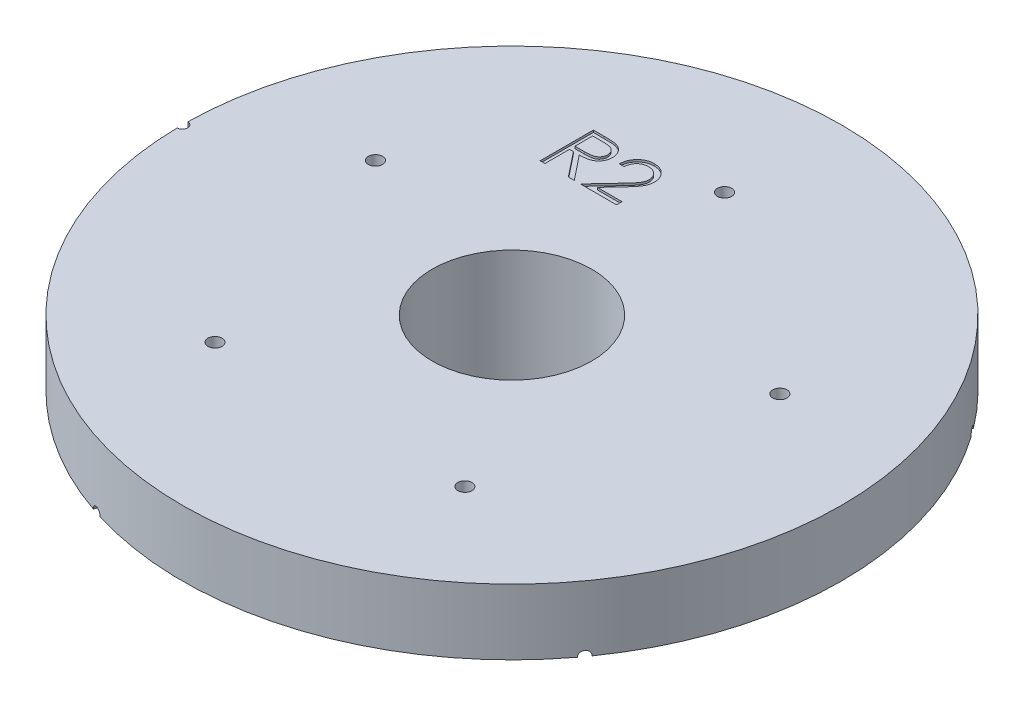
SolidWorks part; units mm, degrees
ref_plane "Front Plane" through (0, 0, 0) normal (0, 0, 1) x (1, 0, 0)
ref_plane "Top Plane" through (0, 0, 0) normal (0, 1, 0) x (1, 0, 0)
ref_plane "Right Plane" through (0, 0, 0) normal (1, 0, 0) x (0, 0, -1)
sketch "Sketch1" plane through (0, 0, 0) normal (0, 0, 1) x (1, 0, 0)
  line L0 (0, 0) -> (42.6331, 0)
  line L4 (67.31, 14.8096) -> (78.74, 14.8096)
  line L5 (78.74, 14.8096) -> (78.74, 30.48)
  line L6 (78.74, 30.48) -> (0, 30.48)
  line L7 (0, 30.48) -> (0, 0)
  line L8 (0, 0) -> (0, 61.9172) construction
  line L9 (-69.2609, 14.8096) -> (69.2609, 14.8096) construction
  line L10 (42.6331, 0) -> (42.6331, 19.4323)
  arc A1 (42.6331, 19.4323) -> (67.31, 14.8096) centre (46.425, -28.5023) cw
  dimension "D5" = 48.0844
  dimension "D1" = 157.48
  dimension "D2" = 30.48
  dimension "D3" = 134.62
  dimension "D4" = 85.2662
  dimension "D6" = 19.4323
revolve "Revolve1" add sketch "Sketch1" angle 360 about L8
other "Cavity1"
other "FAN grommet 2<1>@Vent fan mold1"
sketch "Sketch2" plane through (0, 0, 0) normal (0, -1, 0) x (1, 0, 0)
  circle A0 centre (0, 0) radius 19.05
  dimension "D1" = 38.1
extrude "Cut-Extrude1" cut sketch "Sketch2" against normal through all
ref_plane "Plane1" through (-78.74, 0, 0) normal (-1, 0, 0) x (0, 0, 1)
sketch "Sketch3" plane through (-78.74, 0, 0) normal (-1, 0, 0) x (0, 0, 1)
  line L0 (0, 0) -> (0, 36.7521) construction
  line L1 (-1.27, 14.8096) -> (1.27, 14.8096)
  line L2 (-69.2609, 14.8096) -> (69.2609, 14.8096) construction
  arc A0 (-1.27, 14.8096) -> (1.27, 14.8096) centre (0, 14.8096) cw
  dimension "D1" = 1.27
extrude "Cut-Extrude2" cut sketch "Sketch3" against normal blind 17.526
sketch "Sketch6" plane through (0, 14.8096, 0) normal (0, -1, 0) x (1, 0, 0)
  line L0 (0, 0) -> (-109.7495, 0) construction
  line L1 (-78.74, 8.6187) -> (-78.74, -8.6187) construction
  circle A0 centre (-78.74, 0) radius 1.27
extrude "Cut-Extrude3" cut sketch "Sketch6" against normal through all
pattern_circular "CirPattern1" count 5 over 360 about axis through (0, 30.48, 0) along (0, -1, 0) of "Cut-Extrude2"
hole_wizard "M3 Clearance Hole1" positions "Sketch4" profile "Sketch5" hole size "M3" standard "ANSI Metric"
sketch "Sketch4" plane through (0, 30.48, 0) normal (0, 1, 0) x (1, 0, 0)
  point P0 (0, 50.8)
  dimension "D1" = 50.8
sketch "Sketch5" plane through (0, 30.48, -50.8) normal (1, 0, 0) x (0, 0, 1)
  line L0 (0, 0) -> (0, 30.48)
  line L1 (0, 30.48) -> (1.7, 30.48)
  line L2 (1.7, 30.48) -> (1.7, 0)
  line L5 (1.7, 0) -> (0, 0)
  line L11 (0, -6.35) -> (0, 107.95) construction
  dimension "Thru Hole Dia." = 3.4
  dimension "Thru Hole Depth" = 30.48
pattern_circular "CirPattern2" count 5 over 360 about axis through (0, 0, 0) along (0, 1, 0) of "M3 Clearance Hole1"
sketch "Sketch7" plane through (0, 30.48, 0) normal (0, 1, 0) x (1, 0, 0)
  text T0 "R2" font "Century Gothic" height in points 48
extrude "Cut-Extrude4" cut sketch "Sketch7" against normal blind 0.508
ref_plane "Plane2" through (0, 0, -81.28) normal (0, 0, 1) x (1, 0, 0)
sketch "Sketch10" plane through (0, 0, -81.28) normal (0, 0, 1) x (1, 0, 0)
  text T0 "REVISION 2 " font "Century Gothic" height in points 28
wrap "Wrap1" sketch "Sketch10" wrap type emboss source sketch "Sketch10" thickness 0.254 parameters "D1"=0.254
